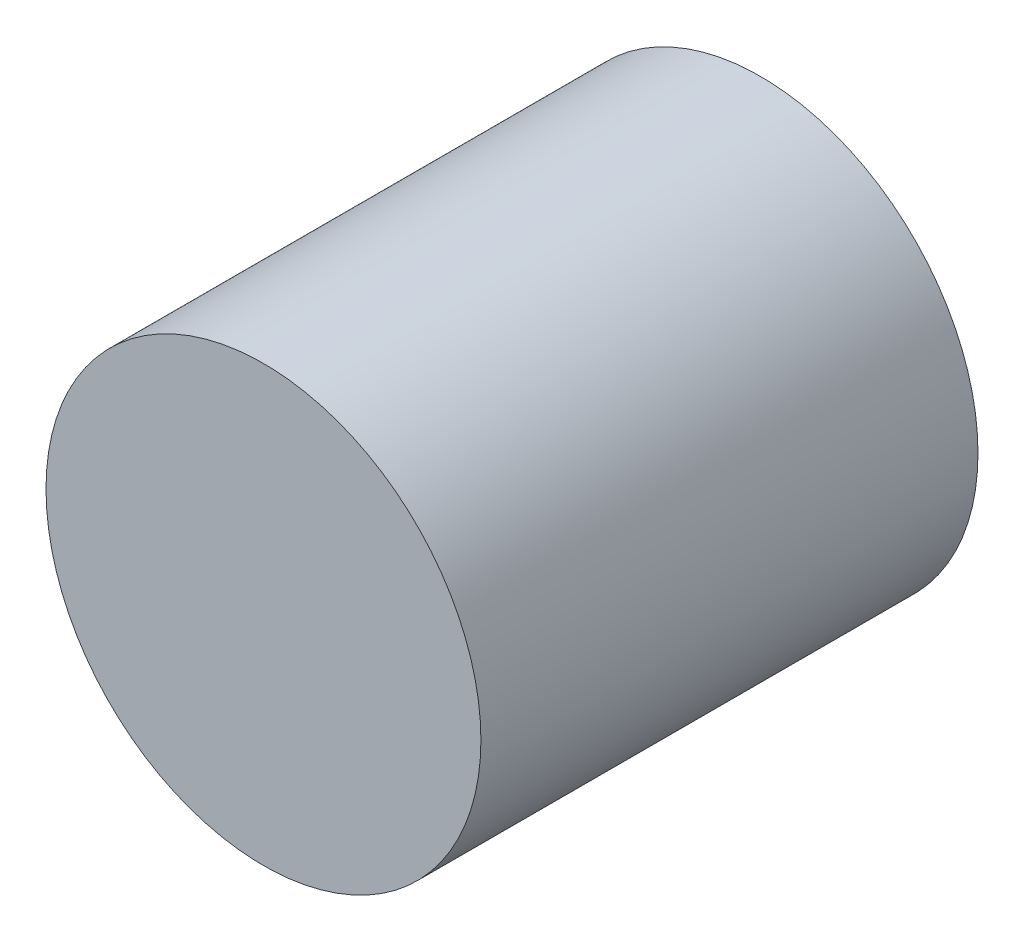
SolidWorks part; units mm, degrees
ref_plane "Спереди" through (0, 0, 0) normal (0, 0, 1) x (1, 0, 0)
ref_plane "Сверху" through (0, 0, 0) normal (0, 1, 0) x (1, 0, 0)
ref_plane "Справа" through (0, 0, 0) normal (1, 0, 0) x (0, 0, -1)
sketch "Эскиз1" plane through (0, 0, 0) normal (0, 0, 1) x (1, 0, 0)
  circle A0 centre (0, 0) radius 17.5006
extrude "Бобышка-Вытянуть1" add sketch "Эскиз1" along normal blind 40.005
sketch "Эскиз2" plane through (0, 0, 0) normal (0, 0, -1) x (-1, 0, 0)
  circle A0 centre (0, 5.08) radius 0.889
  circle A1 centre (0, -5.08) radius 0.889
extrude "Бобышка-Вытянуть2" add sketch "Эскиз2" along normal blind 2.54
